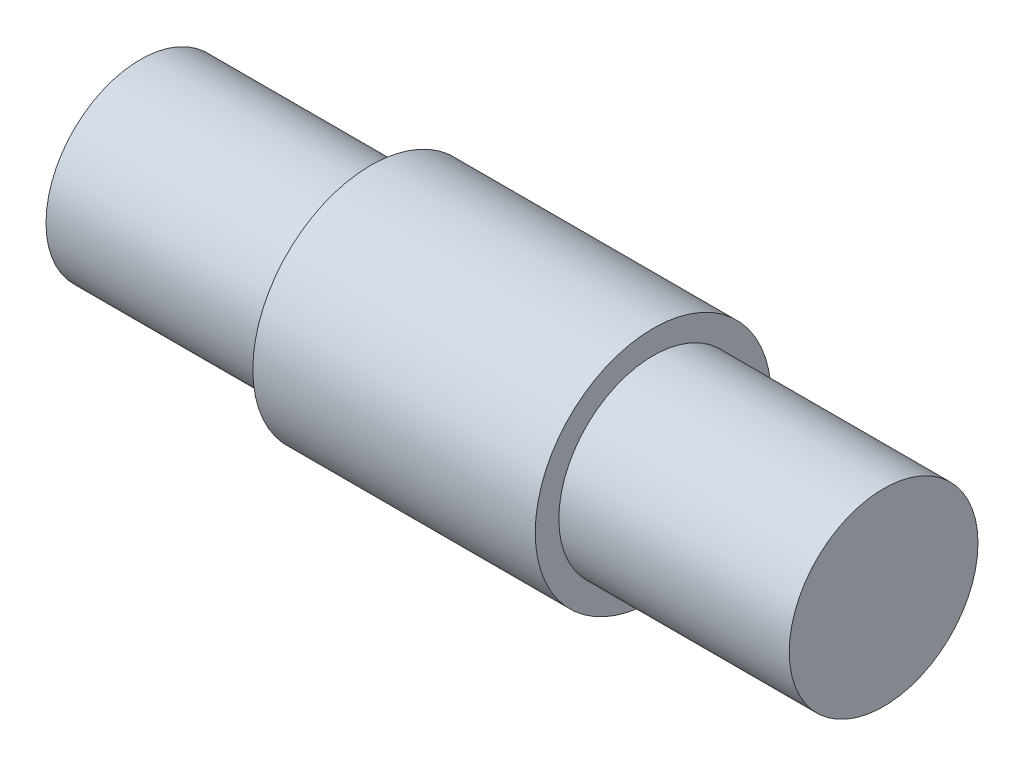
SolidWorks part; units mm, degrees
ref_plane "Front Plane" through (0, 0, 0) normal (0, 0, 1) x (1, 0, 0)
ref_plane "Top Plane" through (0, 0, 0) normal (0, 1, 0) x (1, 0, 0)
ref_plane "Right Plane" through (0, 0, 0) normal (1, 0, 0) x (0, 0, -1)
sketch "Sketch1" plane through (0, 0, 0) normal (0, 0, 1) x (1, 0, 0)
  line L0 (-76.4565, 0) -> (100.0218, 0) construction
  line L1 (-12.5, 0) -> (-12.5, 3.175)
  line L2 (-12.5, 3.175) -> (-4.75, 3.175)
  line L3 (-4.75, 3.175) -> (-4.75, 3.9688)
  line L4 (-4.75, 3.9688) -> (4.75, 3.9688)
  line L5 (4.75, 3.9688) -> (4.75, 3.175)
  line L6 (4.75, 3.175) -> (12.5, 3.175)
  line L7 (12.5, 3.175) -> (12.5, 0)
  line L8 (12.5, 0) -> (-12.5, 0)
  dimension "D1" = 7.75
  dimension "D2" = 25
  dimension "D3" = 7.9375
  dimension "D4" = 6.35
revolve "Revolve1" add sketch "Sketch1" angle 360 about L0
